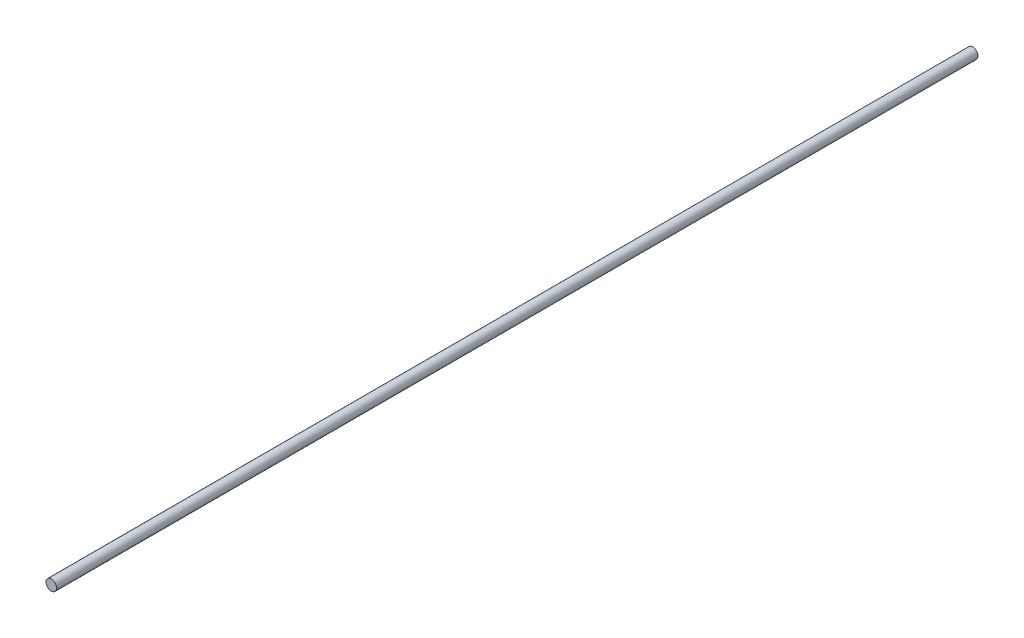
SolidWorks part; units mm, degrees
ref_plane "Front Plane" through (0, 0, 0) normal (0, 0, 1) x (1, 0, 0)
ref_plane "Top Plane" through (0, 0, 0) normal (0, 1, 0) x (1, 0, 0)
ref_plane "Right Plane" through (0, 0, 0) normal (1, 0, 0) x (0, 0, -1)
sketch "Sketch1" plane through (0, 0, 0) normal (0, 0, 1) x (1, 0, 0)
  circle A0 centre (0, 0) radius 30
  dimension "D1" = 60
extrude "Boss-Extrude1" add sketch "Sketch1" against normal blind 5250
